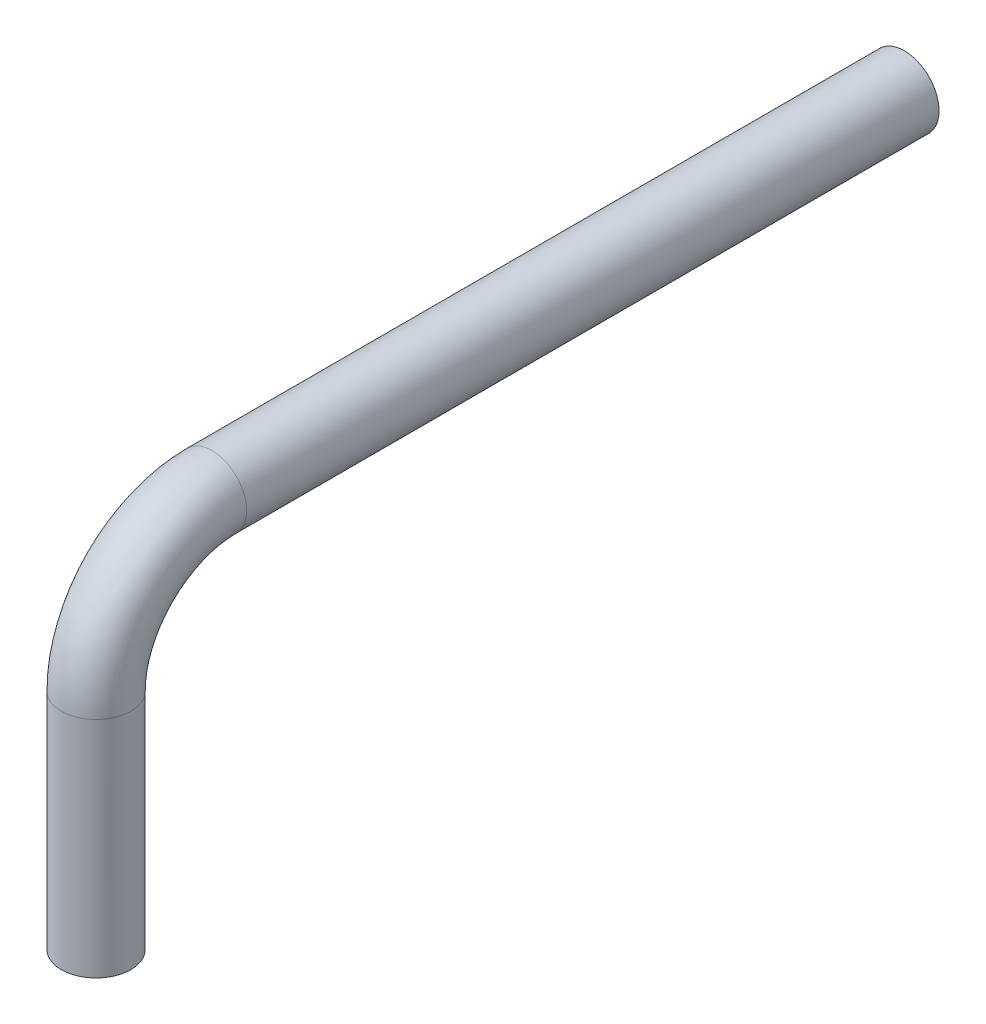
SolidWorks part; units mm, degrees
ref_plane "Plane1" through (0, 0, 0) normal (0, 0, 1) x (1, 0, 0)
ref_plane "Plane2" through (0, 0, 0) normal (0, 1, 0) x (1, 0, 0)
ref_plane "Plane3" through (0, 0, 0) normal (1, 0, 0) x (0, 0, -1)
sketch "Sketch1" plane through (0, 0, 0) normal (0, 0, 1) x (1, 0, 0)
  circle A0 centre (0, 0) radius 0.762
  dimension "D1" = 1.524
extrude "Base-Extrude" add sketch "Sketch1" along normal blind 12.7
sketch "Sketch2" plane through (0, 0, 12.7) normal (0, 0, 1) x (1, 0, 0)
  circle A0 centre (0, 0) radius 0.762
sketch "Sketch3" plane through (0, 0, 0) normal (1, 0, 0) x (0, 0, -1)
  line L0 (-12.7, 0) -> (-15.1871, 0)
  line L1 (-12.7, 0) -> (0, 0) construction
  line L2 (-17.7271, -2.54) -> (-17.7271, -7.45)
  arc A0 (-17.7271, -2.54) -> (-15.1871, 0) centre (-15.1871, -2.54) cw
  point P8 (-17.7271, 0)
  dimension "D1" = 2.54
sweep "Boss-Sweep1" add profiles "Sketch2" path "Sketch3"
